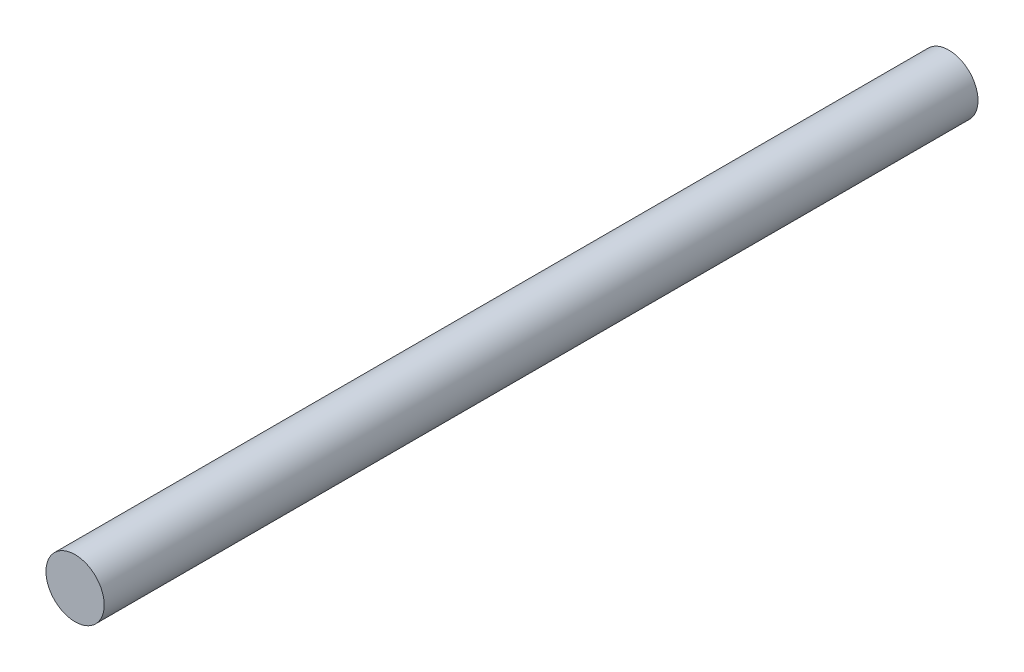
SolidWorks part; units mm, degrees
ref_plane "Front Plane" through (0, 0, 0) normal (1, 0, 0) x (0, 1, 0)
ref_plane "Top Plane" through (0, 0, 0) normal (0, 0, 1) x (0, 1, 0)
ref_plane "Right Plane" through (0, 0, 0) normal (0, 1, 0) x (-1, 0, 0)
sketch "Sketch1" plane through (0, 0, 0) normal (0, 0, 1) x (0, 1, 0)
  circle A0 centre (0, 0) radius 25.4
  dimension "D1" = 50.8
extrude "Boss-Extrude1" add sketch "Sketch1" against normal blind 762
sketch "Sketch2" plane through (0, 0, 0) normal (0, 0, 1) x (0, 1, 0)
  line L1 (21.997, -38.1) -> (43.9941, 0)
  line L2 (43.9941, 0) -> (21.997, 38.1)
  line L3 (21.997, 38.1) -> (-21.997, 38.1)
  line L4 (-21.997, 38.1) -> (-43.9941, 0)
  line L5 (-43.9941, 0) -> (-21.997, -38.1)
  line L6 (-21.997, -38.1) -> (21.997, -38.1)
  circle A0 centre (0, 0) radius 38.1 construction
  dimension "D1" = 76.2
